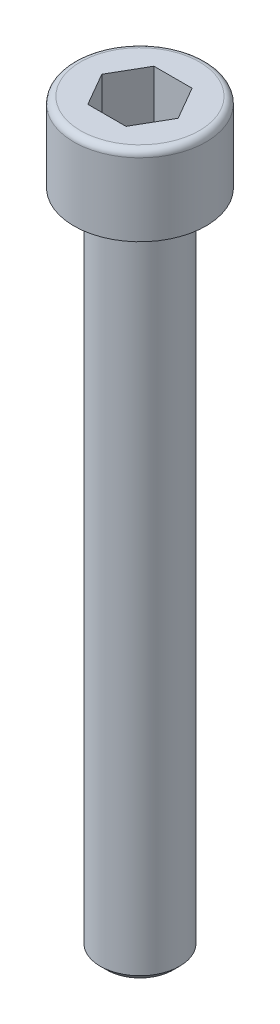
SolidWorks part; units mm, degrees
ref_plane "Plan1" through (0, 0, 0) normal (0, 0, 1) x (1, 0, 0)
ref_plane "Plan2" through (0, 0, 0) normal (0, 1, 0) x (1, 0, 0)
ref_plane "Plan3" through (0, 0, 0) normal (1, 0, 0) x (0, 0, -1)
sketch "Esquisse1" plane through (0, 0, 0) normal (0, 0, 1) x (1, 0, 0)
  line L0 (0, 50) -> (0, -40) construction
  line L1 (0, 56) -> (-4.5, 56)
  line L3 (-5, 55.5) -> (-5, 50)
  line L4 (-5, 50) -> (-3, 50)
  line L7 (-3, 50) -> (-3, 0)
  line L12 (-3, 0) -> (0, 0)
  line L13 (0, 56) -> (0, 0)
  arc A0 (-5, 55.5) -> (-4.5, 56) centre (-4.5, 55.5) cw
  dimension "D1" = 0.5
  dimension "D2" = 5
  dimension "D3" = 50
  dimension "D4" = 6
  dimension "D7" = 3
revolve "Base-Révolution" add sketch "Esquisse1" angle 360 about L0
sketch "Esquisse2" plane through (0, 56, 0) normal (0, 1, 0) x (-1, 0, 0)
  line L1 (1.4434, 2.5) -> (-1.4434, 2.5)
  line L2 (-1.4434, 2.5) -> (-2.8868, 0)
  line L3 (-2.8868, 0) -> (-1.4434, -2.5)
  line L4 (-1.4434, -2.5) -> (1.4434, -2.5)
  line L5 (1.4434, -2.5) -> (2.8868, 0)
  line L6 (2.8868, 0) -> (1.4434, 2.5)
  circle A0 centre (0, 0) radius 2.5 construction
  dimension "D1" = 5
extrude "Enlèv. mat.-Extru.1" cut sketch "Esquisse2" against normal blind 5
chamfer "Chanfrein1" distance 0.5 angle 45
